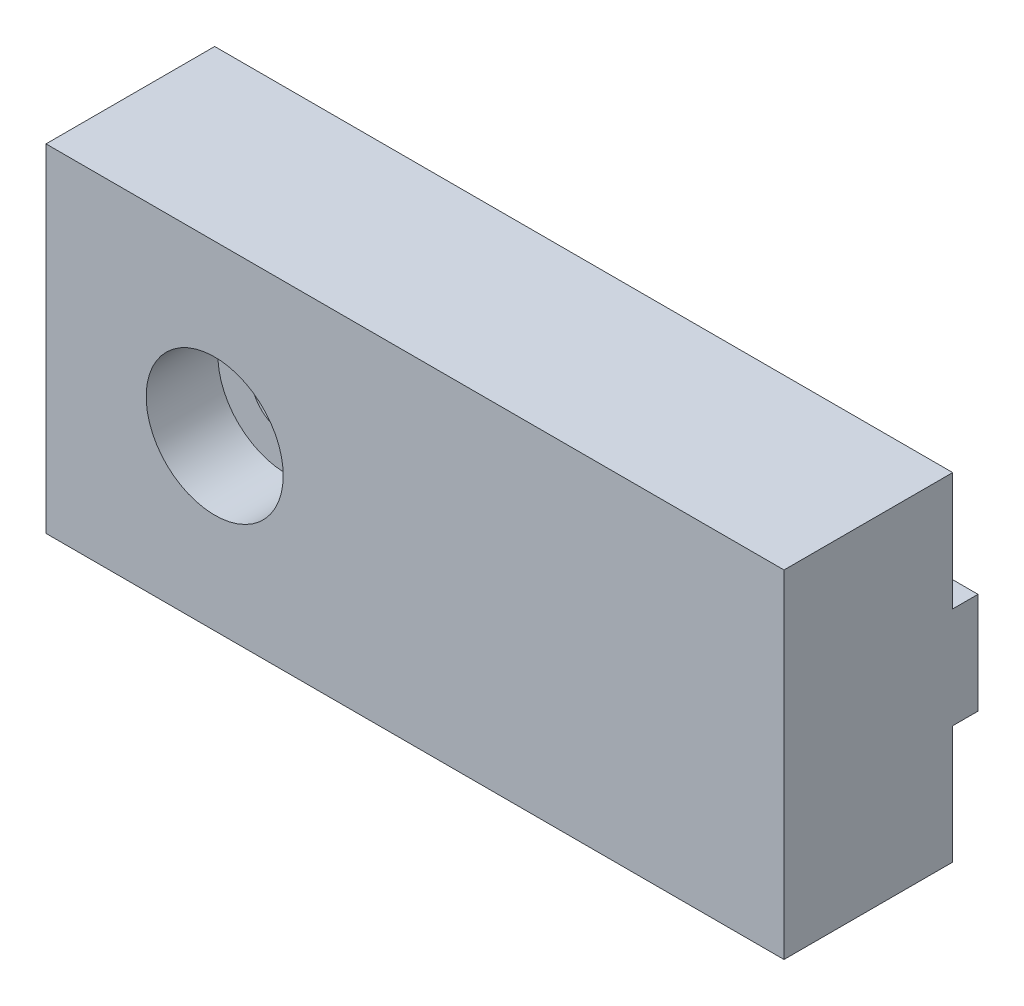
SolidWorks part; units mm, degrees
ref_plane "Aufriss" through (0, 0, 0) normal (0, 0, 1) x (1, 0, 0)
ref_plane "Grundriss" through (0, 0, 0) normal (0, 1, 0) x (1, 0, 0)
ref_plane "Seitenriss" through (0, 0, 0) normal (1, 0, 0) x (0, 0, -1)
sketch "Skizze1" plane through (0, 0, 0) normal (0, 0, 1) x (1, 0, 0)
  line L1 (-17.5, -8) -> (17.5, -8)
  line L2 (-17.5, -8) -> (-17.5, 8)
  line L3 (-17.5, 8) -> (17.5, 8)
  line L4 (17.5, -8) -> (17.5, 8)
  line L5 (-17.5, -8) -> (17.5, 8) construction
  line L6 (-17.5, 8) -> (17.5, -8) construction
  point P0 (0, 0)
  dimension "D1" = 16
  dimension "D2" = 35
extrude "Aufsatz-Linear austragen1" add sketch "Skizze1" along normal blind 8
sketch "Skizze2" plane through (0, 0, 0) normal (0, 0, -1) x (-1, 0, 0)
  line L0 (-17.5, -8) -> (-17.5, 8) construction
  line L1 (-17.5, 2.4) -> (17.5, 2.4)
  line L2 (-17.5, 2.4) -> (-17.5, -2.4)
  line L3 (-17.5, -2.4) -> (17.5, -2.4)
  line L4 (17.5, 2.4) -> (17.5, -2.4)
  line L5 (17.5, 8) -> (17.5, -8) construction
  line L6 (-17.5, 0) -> (0, 0) construction
  dimension "D1" = 4.8
extrude "Aufsatz-Linear austragen2" add sketch "Skizze2" along normal blind 1.2
hole_wizard "Stirnsenkung für M3 Zylinderschraube mit Innensechskant1" positions "Skizze3" profile "Skizze4" counterbore size "M3" standard "DIN"
sketch "Skizze3" plane through (0, 0, 8) normal (0, 0, 1) x (1, 0, 0)
  line L0 (-17.5, 8) -> (-17.5, -8) construction
  point P0 (-9.5, 0)
  dimension "D1" = 8
sketch "Skizze4" plane through (-9.5, 0, 8) normal (1, 0, 0) x (0, -1, 0)
  line L0 (0, 0) -> (0, 9.2)
  line L1 (0, 9.2) -> (1.7, 9.2)
  line L3 (1.7, 9.2) -> (1.7, 3.4)
  line L4 (1.7, 3.4) -> (3.25, 3.4)
  line L5 (3.25, 3.4) -> (3.25, 0)
  line L7 (3.25, 0) -> (0, 0)
  line L11 (0, -6.35) -> (0, 107.95) construction
  dimension "Bohrerdurchmesser" = 3.4
  dimension "Bohrungstiefe" = 9.2
  dimension "Senkdurchmesser2" = 6.5
  dimension "Senktiefe2" = 3.4
